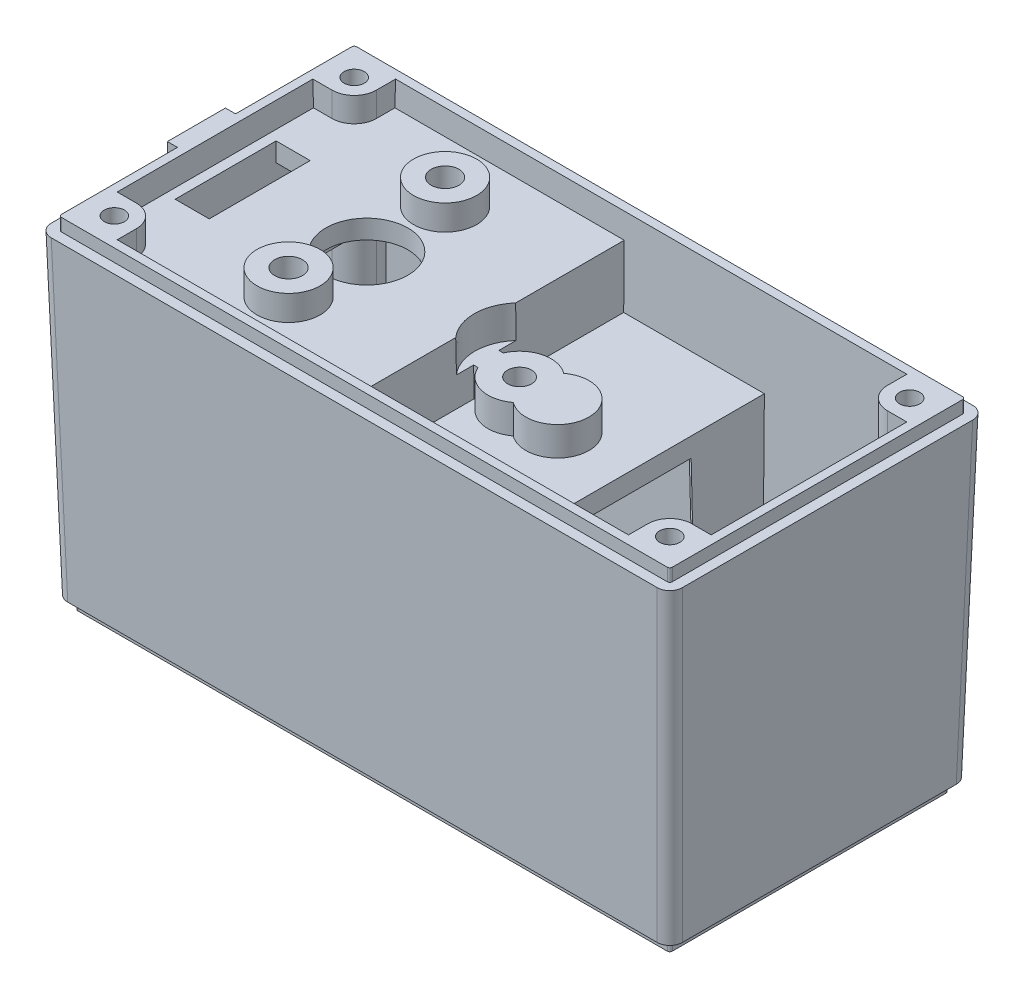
SolidWorks part; units mm, degrees
ref_plane "Front" through (0, 0, 0) normal (0, 0, 1) x (1, 0, 0)
ref_plane "Top" through (0, 0, 0) normal (0, 1, 0) x (1, 0, 0)
ref_plane "Right" through (0, 0, 0) normal (1, 0, 0) x (0, 0, -1)
imported_body "Imported3"
sketch "Sketch1" plane through (0, -14.75, 0) normal (0, 1, 0) x (-1, 0, 0)
  line L0 (-22.1, 0.8078) -> (-22.1, -0.8078)
  arc A0 (-22.1, -0.8078) -> (-22.1, 0.8078) centre (-24.2, 0) cw
extrude "Boss-Extrude1" add sketch "Sketch1" along normal blind 2.2
sketch "Sketch2" plane through (-13.5, 0, 0) normal (-1, 0, 0) x (0, 0, 1)
  line L0 (-2.3, 0) -> (-2.3, 1)
  line L1 (-2.3, 1) -> (-11.7, 1)
  line L2 (-11.7, 1) -> (-11.7, 0)
  line L3 (-11.7, 0) -> (-2.3, 0)
extrude "Cut-Extrude1" cut sketch "Sketch2" against normal blind 0.8
sketch "Sketch3" plane through (-13.5, 0, 0) normal (-1, 0, 0) x (0, 0, 1)
  line L0 (2.3, 0) -> (11.7, 0)
  line L1 (11.7, 0) -> (11.7, 1)
  line L2 (11.7, 1) -> (2.3, 1)
  line L3 (2.3, 1) -> (2.3, 0)
extrude "Cut-Extrude2" cut sketch "Sketch3" against normal blind 0.8
sketch "Sketch4" plane through (0, -5.8, 0) normal (0, 1, 0) x (-1, 0, 0)
  arc A0 (-13.6, -2) -> (-13.6, 2) centre (-15.1, 0) cw
  arc A1 (-13.6, 2) -> (-13.6, -2) centre (-12.1, 0) ccw
extrude "Boss-Extrude2" add sketch "Sketch4" along normal blind 2.3
sketch "Sketch5" plane through (0, -7.3, 0) normal (0, -1, 0) x (1, 0, 0)
  arc A0 (13.6, 2) -> (13.6, -2) centre (15.1, 0) cw
  arc A1 (13.6, -2) -> (13.6, 2) centre (12.1, 0) cw
extrude "Boss-Extrude3" add sketch "Sketch5" along normal blind 1.5
ref_plane "Plane1" through (0, 0, -6.2) normal (0, 0, -1) x (-1, 0, 0)
sketch "Sketch6" plane through (0, 0, -6.2) normal (0, 0, -1) x (-1, 0, 0)
  line L0 (-2.5, -0.95) -> (0, -0.95)
  line L1 (0, -0.95) -> (0, 1.05)
  line L2 (0, 1.05) -> (-2.5, 1.05)
  line L3 (-2.5, 1.05) -> (-2.5, -0.95)
  line L4 (0, -0.95) -> (0, 1.05) construction
revolve "Revolve1" add sketch "Sketch6" angle 360 about L4
ref_plane "Plane2" through (0, 0, 6.2) normal (0, 0, -1) x (-1, 0, 0)
sketch "Sketch7" plane through (0, 0, 6.2) normal (0, 0, -1) x (-1, 0, 0)
  line L0 (-2.5, -0.95) -> (0, -0.95)
  line L1 (0, -0.95) -> (0, 1.05)
  line L2 (0, 1.05) -> (-2.5, 1.05)
  line L3 (-2.5, 1.05) -> (-2.5, -0.95)
  line L4 (0, -0.95) -> (0, 1.05) construction
revolve "Revolve2" add sketch "Sketch7" angle 360 about L4
ref_plane "Plane3" through (0, 0, 0) normal (0, 0, -1) x (-1, 0, 0)
sketch "Sketch8" plane through (0, 0, 0) normal (0, 0, -1) x (-1, 0, 0)
  line L0 (-27.7, -19.1) -> (-25.7, -19.1)
  line L1 (-25.7, -19.1) -> (-25.7, -16.25)
  line L2 (-25.7, -16.25) -> (-27.7, -16.25)
  line L3 (-27.7, -16.25) -> (-27.7, -19.1)
  line L4 (-25.7, -19.1) -> (-25.7, -16.25) construction
revolve "Revolve3" add sketch "Sketch8" angle 360 about L4
hole_wizard "Hole1" positions "Sketch10" profile "Sketch9" legacy
sketch "Sketch10" plane through (0, 1, 0) normal (0, 1, 0) x (1, 0, 0)
  point P0 (-10.5, 9.5)
  point P1 (-10.5, -9.5)
  point P2 (33.5, -9.5)
  point P3 (33.5, 9.5)
sketch "Sketch9" plane through (-10.5, 1, -9.5) normal (1, 0, 0) x (0, 0, 1)
  line L0 (0, 0) -> (0, 27.0001)
  line L1 (0, 27.0001) -> (0.8, 27.0001)
  line L2 (0.8, 27.0001) -> (0.8, 0)
  line L3 (0.8, 0) -> (0, 0)
  line L4 (0, 110) -> (0, -10) construction
  dimension "Diameter" = 1.6
  dimension "Depth" = 27.0001
hole_wizard "Hole2" positions "Sketch12" profile "Sketch11" legacy
sketch "Sketch12" plane through (0, -0.95, 0) normal (0, 1, 0) x (1, 0, 0)
  point P0 (0, 0)
sketch "Sketch11" plane through (0, -0.95, 0) normal (1, 0, 0) x (0, 0, 1)
  line L0 (0, 0) -> (0, 25.0501)
  line L1 (0, 25.0501) -> (3.25, 25.0501)
  line L2 (3.25, 25.0501) -> (3.25, 0)
  line L3 (3.25, 0) -> (0, 0)
  line L4 (0, 110) -> (0, -10) construction
  dimension "Diameter" = 6.5
  dimension "Depth" = 25.0501
hole_wizard "Hole3" positions "Sketch14" profile "Sketch13" legacy
sketch "Sketch14" plane through (0, -3.5, 0) normal (0, 1, 0) x (1, 0, 0)
  point P0 (12.1, 0)
sketch "Sketch13" plane through (12.1, -3.5, 0) normal (1, 0, 0) x (0, 0, 1)
  line L0 (0, 0) -> (0, 4.8)
  line L1 (0, 4.8) -> (0.95, 4.8)
  line L2 (0.95, 4.8) -> (0.95, 0)
  line L3 (0.95, 0) -> (0, 0)
  line L4 (0, 110) -> (0, -10) construction
  dimension "Diameter" = 1.9
  dimension "Depth" = 4.8
hole_wizard "#1 Clearance Hole1" positions "Sketch16" profile "Sketch15" hole size "#1" standard "ANSI Inch"
sketch "Sketch16" plane through (0, -2.45, 0) normal (0, -1, 0) x (-1, 0, 0)
  point P0 (0, 6.2)
  point P1 (0, -6.2)
sketch "Sketch15" plane through (0, -2.45, -6.2) normal (1, 0, 0) x (0, 0, -1)
  line L0 (0, 0) -> (0, 3.5)
  line L1 (0, 3.5) -> (1.1, 3.5)
  line L2 (1.1, 3.5) -> (1.1, 0)
  line L5 (1.1, 0) -> (0, 0)
  line L11 (0, -6.35) -> (0, 107.95) construction
  dimension "Thru Hole Dia." = 2.2
  dimension "Thru Hole Depth" = 3.5
hole_wizard "Hole4" positions "Sketch18" profile "Sketch17" legacy
sketch "Sketch18" plane through (0, -12.55, 0) normal (0, 1, 0) x (1, 0, 0)
  point P0 (24.2, 0)
sketch "Sketch17" plane through (24.2, -12.55, 0) normal (1, 0, 0) x (0, 0, 1)
  line L0 (0, 0) -> (0, 2.8)
  line L1 (0, 2.8) -> (0.95, 2.8)
  line L2 (0.95, 2.8) -> (0.95, 0)
  line L3 (0.95, 0) -> (0, 0)
  line L4 (0, 110) -> (0, -10) construction
  dimension "Diameter" = 1.9
  dimension "Depth" = 2.8
hole_wizard "Hole5" positions "Sketch20" profile "Sketch19" legacy
sketch "Sketch20" plane through (0, -8.8, 0) normal (0, -1, 0) x (-1, 0, 0)
  point P0 (-15.1, 0)
sketch "Sketch19" plane through (15.1, -8.8, 0) normal (1, 0, 0) x (0, 0, -1)
  line L0 (0, 0) -> (0, 4.8)
  line L1 (0, 4.8) -> (0.95, 4.8)
  line L2 (0.95, 4.8) -> (0.95, 0)
  line L3 (0.95, 0) -> (0, 0)
  line L4 (0, 110) -> (0, -10) construction
  dimension "Diameter" = 1.9
  dimension "Depth" = 4.8
fillet "Fillet1" radius 0.1995 8 edges at (35.0454, -25.5, 11.0454) (-12.7, 0.5, 11.7) (35.7, 0.5, 11.7) (-12.0454, -25.5, -11.0454) (35.0454, -25.5, -11.0454) (-12.7, 0.5, -11.7) (-12.0454, -25.5, 11.0454) (35.7, 0.5, -11.7)
fillet "Fillet2" radius 1 4 edges at (-13.1727, -12.5, 12.1727) (-13.1727, -12.5, -12.1727) (36.1727, -12.5, -12.1727) (36.1727, -12.5, 12.1727)
fillet "Fillet3" radius 1.75 6 edges at (31.75, -6.875, 7.75) (-8.75, 0.025, -7.75) (31.75, -21.125, -7.75) (-8.75, 0.025, 7.75) (31.75, -21.125, 7.75) (31.75, -6.875, -7.75)
